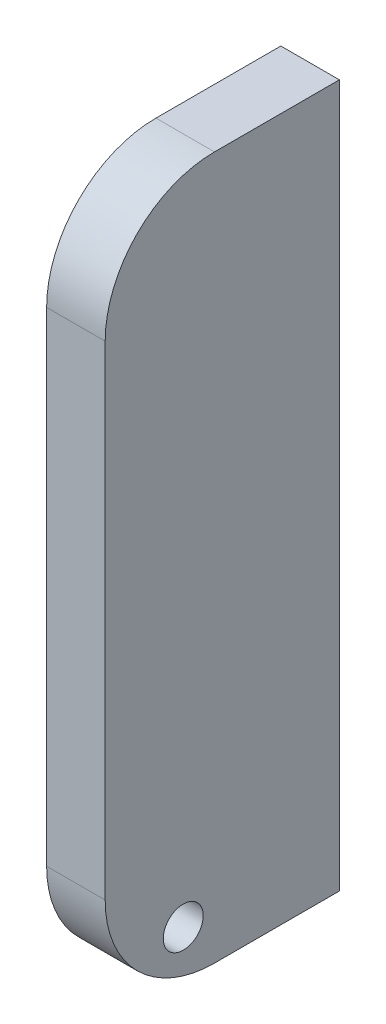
SolidWorks part; units mm, degrees
ref_plane "Front Plane" through (0, 0, 0) normal (0, 0, 1) x (1, 0, 0)
ref_plane "Top Plane" through (0, 0, 0) normal (0, 1, 0) x (1, 0, 0)
ref_plane "Right Plane" through (0, 0, 0) normal (1, 0, 0) x (0, 0, -1)
sketch "Sketch1" plane through (0, 0, 0) normal (0, 0, 1) x (1, 0, 0)
  line L0 (-118.25, -31.75) -> (-118.25, 114.3) construction
  line L1 (-118.25, -19.05) -> (-108.725, -19.05)
  line L2 (-118.25, -19.05) -> (-118.25, 95.25)
  line L3 (-118.25, 95.25) -> (-108.725, 95.25)
  line L4 (-108.725, -19.05) -> (-108.725, 95.25)
  line L5 (105.55, -44.45) -> (-105.55, -44.45) construction
  dimension "D1" = 9.525
  dimension "D2" = 114.3
  dimension "D3" = 25.4
extrude "Boss-Extrude1" add sketch "Sketch1" along normal blind 38.1
fillet "Fillet1" radius 17.78 2 edges at (-113.4875, 95.25, 38.1) (-113.4875, -19.05, 38.1)
sketch "Sketch2" plane through (-118.25, 0, 0) normal (-1, 0, 0) x (0, 0, 1)
  line L0 (0, -11.43) -> (38.1, -11.43) construction
  line L1 (20.32, -19.05) -> (0, -19.05) construction
  circle A0 centre (25.4, -11.43) radius 3.25
  dimension "D2" = 6.5
  dimension "D1" = 12.7
  dimension "D3" = 7.62
extrude "Cut-Extrude1" cut sketch "Sketch2" against normal through all
